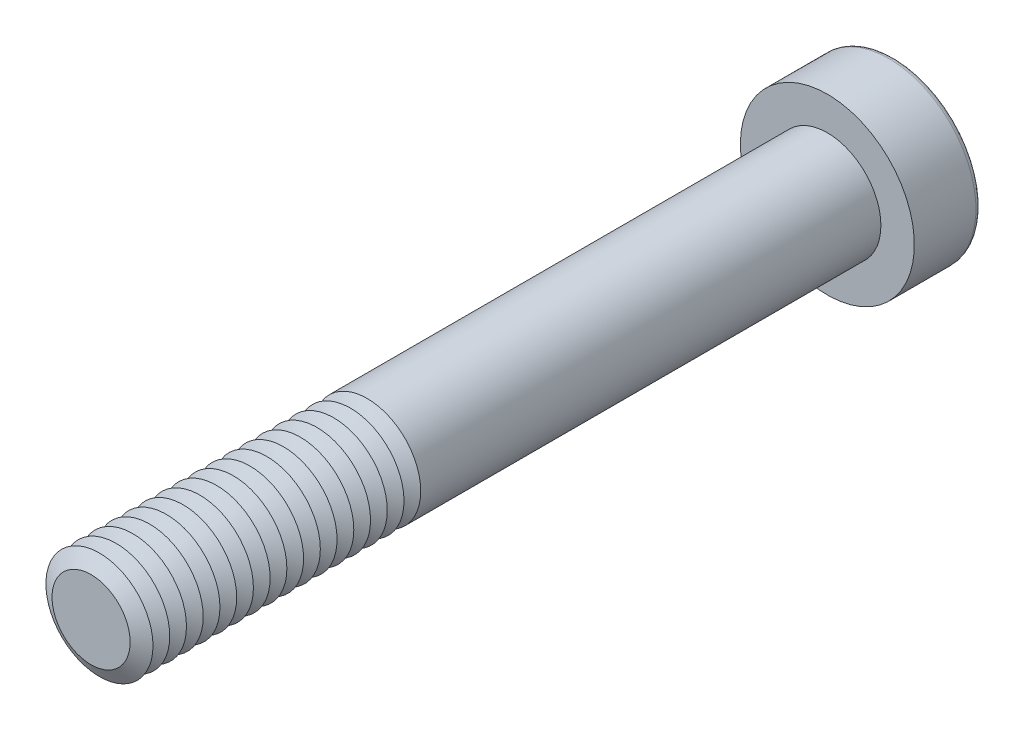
SolidWorks part; units mm, degrees
ref_plane "Front Plane" through (0, 0, 0) normal (0, 0, 1) x (1, 0, 0)
ref_plane "Top Plane" through (0, 0, 0) normal (0, 1, 0) x (1, 0, 0)
ref_plane "Right Plane" through (0, 0, 0) normal (1, 0, 0) x (0, 0, -1)
sketch "Sketch1" plane through (0, 0, 0) normal (0, 0, 1) x (1, 0, 0)
  circle A0 centre (0, 0) radius 4
  dimension "D1" = 8
extrude "Boss-Extrude1" add sketch "Sketch1" along normal blind 55
sketch "Sketch2" plane through (0, 0, 0) normal (0, 0, -1) x (-1, 0, 0)
  circle A0 centre (0, 0) radius 6.5
  dimension "D1" = 13
extrude "Boss-Extrude2" add sketch "Sketch2" along normal blind 5
sketch "Sketch3" plane through (0, 0, -5) normal (0, 0, -1) x (-1, 0, 0)
  line L1 (-1.4434, 2.5) -> (-2.8868, 0)
  line L2 (-2.8868, 0) -> (-1.4434, -2.5)
  line L3 (-1.4434, -2.5) -> (1.4434, -2.5)
  line L4 (1.4434, -2.5) -> (2.8868, 0)
  line L5 (2.8868, 0) -> (1.4434, 2.5)
  line L6 (1.4434, 2.5) -> (-1.4434, 2.5)
  circle A0 centre (0, 0) radius 2.5 construction
  dimension "D1" = 5
extrude "Cut-Extrude1" cut sketch "Sketch3" against normal blind 3.75
fillet "Fillet1" radius 0.4 1 edges at (-6.5, 0, -5)
sketch "Sketch4" plane through (0, 0, -1.25) normal (0, 0, -1) x (-1, 0, 0)
  line L0 (1.4434, -2.5) -> (2.8868, 0) construction
  circle A0 centre (0, 0) radius 2.5
extrude "Cut-Extrude2" cut sketch "Sketch4" against normal through all draft 60
sketch "Sketch5" plane through (0, 0, -5) normal (0, 0, -1) x (-1, 0, 0)
  circle A0 centre (0, 0) radius 2.8868
extrude "Cut-Extrude3" cut sketch "Sketch5" against normal through all draft 75
sketch "Sketch7" plane through (0, 0, 0) normal (1, 0, 0) x (0, 0, -1)
  line L25 (-55, 2.9175) -> (-54.375, 4)
  line L26 (-55, 4) -> (-55, -4) construction
  line L27 (-54.375, 4) -> (-55.625, 4)
  line L28 (-55.625, 4) -> (-55, 2.9175)
  line L29 (0, 4) -> (-55, 4) construction
  dimension "D1" = 1.25
revolve "Cut-Revolve1" cut sketch "Sketch7" angle 360 about axis through (0, 0, 55) along (0, 0, -1)
pattern_linear "LPattern1" count 17 spacing 1.25 along (0, 0, -1) of "Cut-Revolve1"
